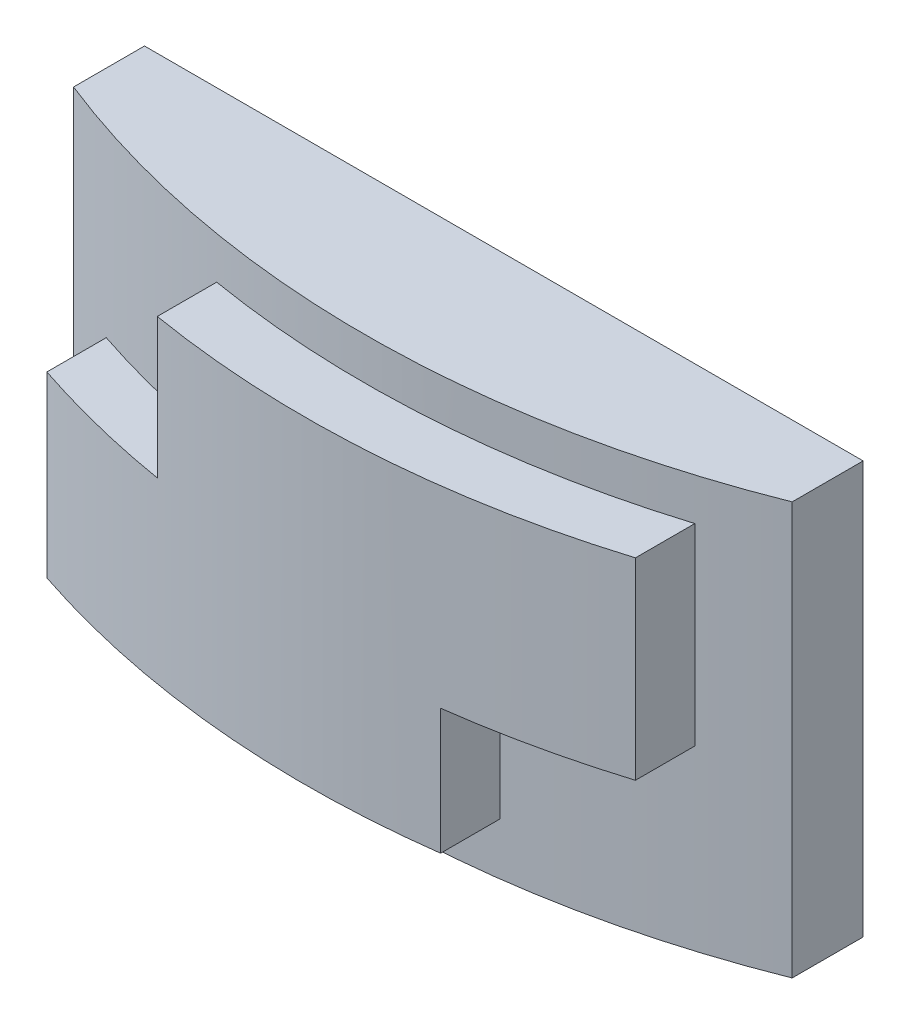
SolidWorks part; units mm, degrees
ref_plane "Front" through (0, 0, 0) normal (0, 0, 1) x (1, 0, 0)
ref_plane "Top" through (0, 0, 0) normal (0, 1, 0) x (1, 0, 0)
ref_plane "Right" through (0, 0, 0) normal (1, 0, 0) x (0, 0, -1)
sketch "Sketch2" plane through (0, 0, 0) normal (0, 1, 0) x (1, 0, 0)
  line L0 (-59.3912, 0) -> (-59.3912, 11.9529)
  line L1 (-59.3912, 11.9529) -> (61.6324, 11.9529)
  line L2 (61.6324, 11.9529) -> (61.6324, 0)
  arc A0 (-59.3912, 0) -> (61.6324, 0) centre (1.1206, 152.2675) ccw
extrude "Extrude2" add sketch "Sketch2" along normal blind 69.4428
ref_plane "Plane1" through (0, 0, -82.3326) normal (0, 0, 1) x (1, 0, 0)
sketch "Sketch3" plane through (0, 0, -82.3326) normal (0, 0, 1) x (1, 0, 0)
  line L1 (22.5924, 8.76) -> (22.5924, 29.9103)
  line L2 (22.5924, 29.9103) -> (49.511, 29.9103)
  line L3 (49.511, 29.9103) -> (49.511, 62.3569)
  line L4 (49.511, 62.3569) -> (-25.9572, 62.3569)
  line L5 (-25.9572, 62.3569) -> (-25.9572, 38.8031)
  line L6 (-25.9572, 38.8031) -> (-50.7127, 38.8031)
  line L7 (-50.7127, 38.8031) -> (-50.7127, 8.76)
  line L8 (-50.7127, 8.76) -> (22.5924, 8.76)
extrude "Boss-Extrude1" add sketch "Sketch3" along normal blind 10 from surface
